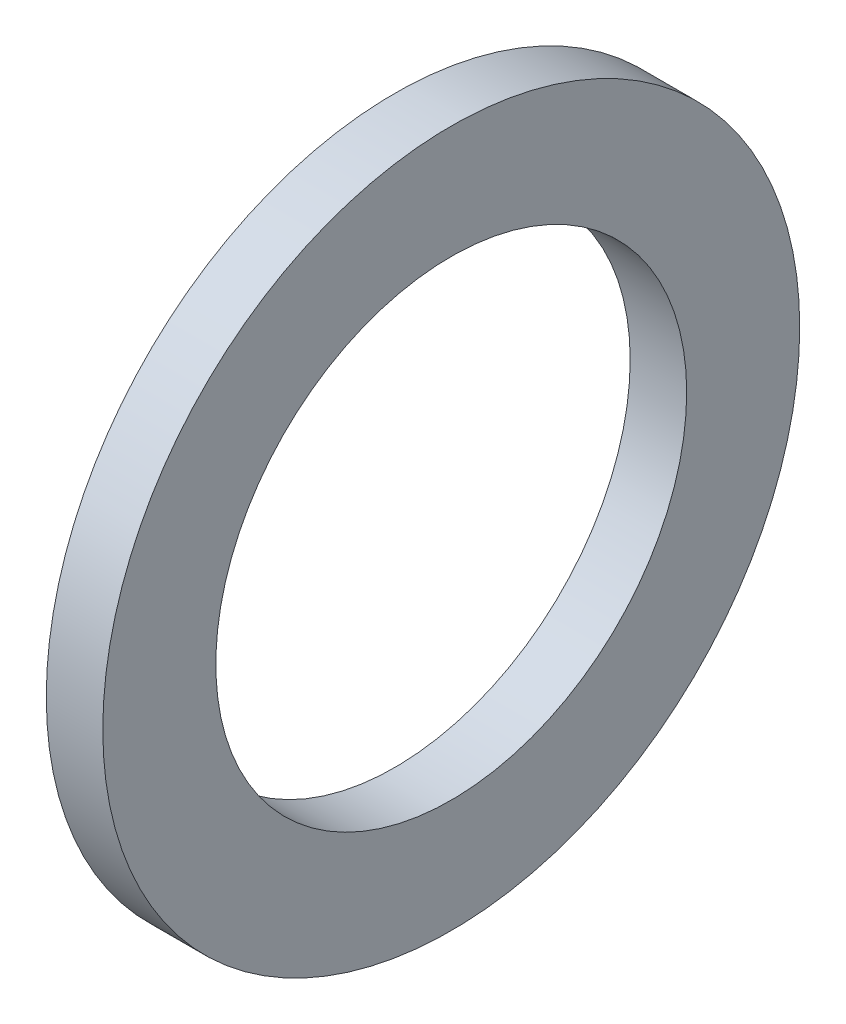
SolidWorks part; units mm, degrees
ref_plane "frontal" through (0, 0, 0) normal (0, 0, 1) x (1, 0, 0)
ref_plane "horizontal" through (0, 0, 0) normal (0, 1, 0) x (1, 0, 0)
ref_plane "profil" through (0, 0, 0) normal (1, 0, 0) x (0, 0, -1)
sketch "Esquisse1" plane through (0, 0, 0) normal (1, 0, 0) x (0, 0, -1)
  circle A0 centre (0, 0) radius 18.5
  circle A1 centre (0, 0) radius 12.5
  dimension "D1" = 25
  dimension "D2" = 37
extrude "Base-Extrusion" add sketch "Esquisse1" along normal blind 3
